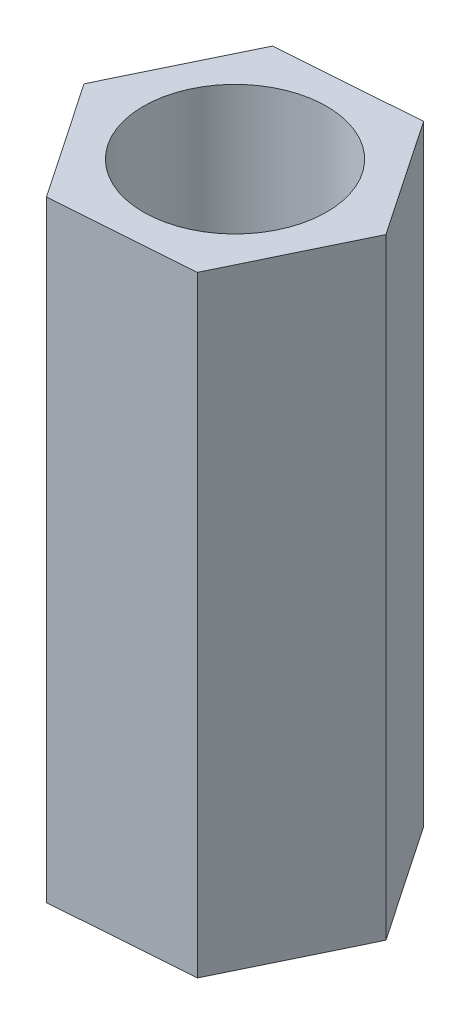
SolidWorks part; units mm, degrees
ref_plane "Front Plane" through (0, 0, 0) normal (0, 0, 1) x (1, 0, 0)
ref_plane "Top Plane" through (0, 0, 0) normal (0, 1, 0) x (1, 0, 0)
ref_plane "Right Plane" through (0, 0, 0) normal (1, 0, 0) x (0, 0, -1)
sketch "Sketch1" plane through (0, 0, 0) normal (0, 1, 0) x (1, 0, 0)
  line L1 (1.2965, -1.9112) -> (2.3033, 0.1672)
  line L2 (2.3033, 0.1672) -> (1.0069, 2.0783)
  line L3 (1.0069, 2.0783) -> (-1.2965, 1.9112)
  line L4 (-1.2965, 1.9112) -> (-2.3033, -0.1672)
  line L5 (-2.3033, -0.1672) -> (-1.0069, -2.0783)
  line L6 (-1.0069, -2.0783) -> (1.2965, -1.9112)
  circle A0 centre (0, 0) radius 2 construction
  circle A1 centre (0, 0) radius 1.5
extrude "Boss-Extrude1" add sketch "Sketch1" along normal blind 10
